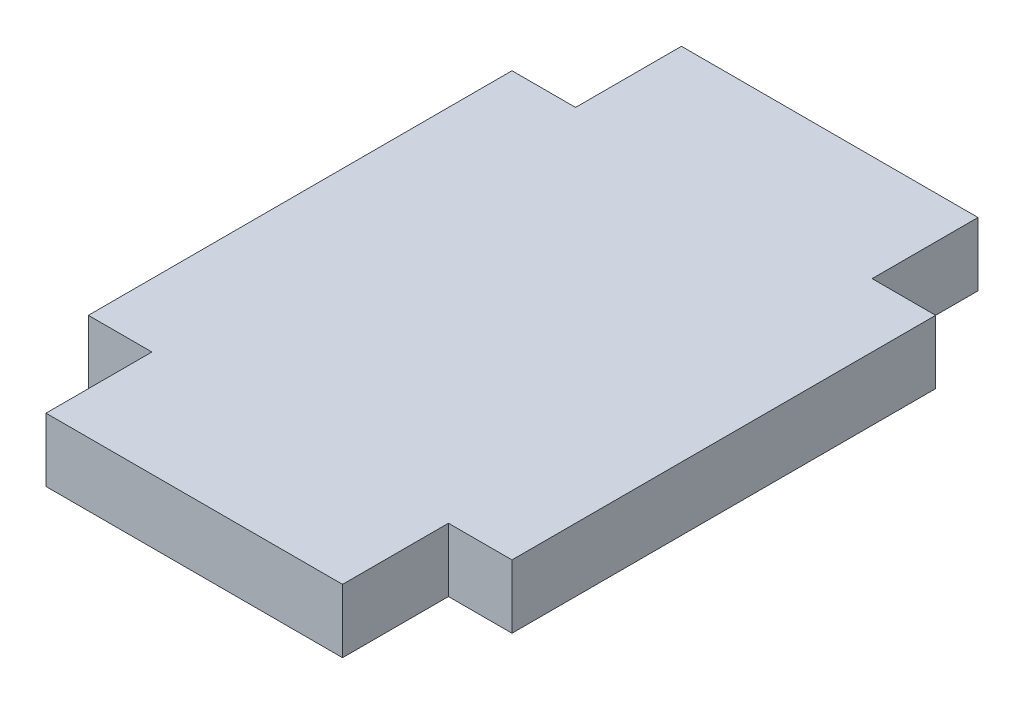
SolidWorks part; units mm, degrees
ref_plane "Ön Düzlem" through (0, 0, 0) normal (0, 0, 1) x (1, 0, 0)
ref_plane "Üst Düzlem" through (0, 0, 0) normal (0, 1, 0) x (1, 0, 0)
ref_plane "Sağ Düzlem" through (0, 0, 0) normal (1, 0, 0) x (0, 0, -1)
sketch "Çizim1" plane through (0, 0, 0) normal (0, 1, 0) x (1, 0, 0)
  line L0 (-14, -20) -> (-20, -20)
  line L1 (-14, 30) -> (14, 30)
  line L2 (-14, 30) -> (-14, 20)
  line L3 (-14, -30) -> (14, -30)
  line L4 (14, 30) -> (14, 20)
  line L5 (-14, 30) -> (14, -30) construction
  line L6 (-14, -30) -> (14, 30) construction
  line L7 (-20, -20) -> (-20, 20)
  line L8 (-20, 20) -> (-14, 20)
  line L9 (0, 30) -> (0, -30) construction
  line L10 (14, -20) -> (20, -20)
  line L11 (20, 20) -> (14, 20)
  line L12 (20, -20) -> (20, 20)
  line L13 (-14, -20) -> (-14, -30)
  line L14 (14, -20) -> (14, -30)
  point P0 (0, 0)
  dimension "D1" = 40
  dimension "D2" = 6
  dimension "D3" = 60
  dimension "D4" = 10
  dimension "D5" = 28
extrude "Yükseklik-Ekstrüzyon1" add sketch "Çizim1" along normal blind 6
